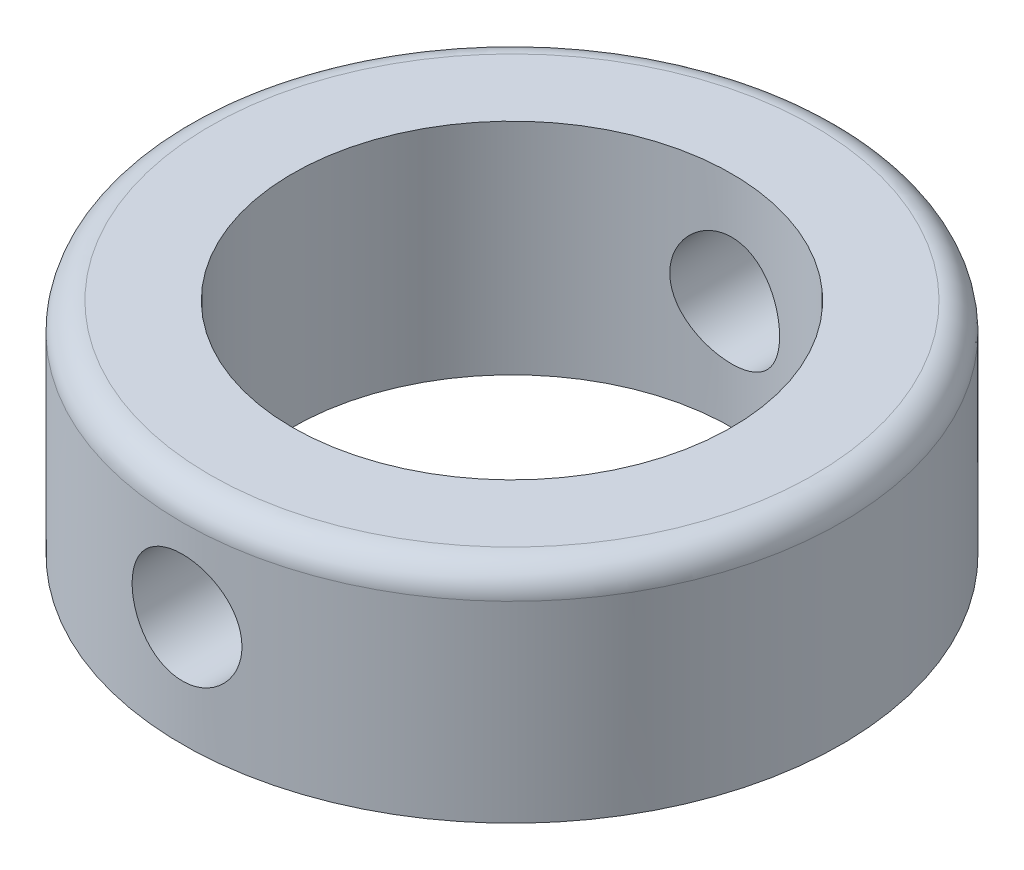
SolidWorks part; units mm, degrees
ref_plane "Front Plane" through (0, 0, 0) normal (0, 0, 1) x (1, 0, 0)
ref_plane "Top Plane" through (0, 0, 0) normal (0, 1, 0) x (1, 0, 0)
ref_plane "Right Plane" through (0, 0, 0) normal (1, 0, 0) x (0, 0, -1)
sketch "Sketch1" plane through (0, 0, 0) normal (0, 0, 1) x (1, 0, 0)
  line L0 (6, 5.9842) -> (0, 5.9842)
  line L1 (0, 5.9842) -> (0, 1.9842)
  line L2 (0, 1.9842) -> (6, 1.9842)
  line L3 (6, 1.9842) -> (6, 5.9842)
  line L4 (0, 5.9842) -> (0, 1.9827) construction
revolve "Revolve1" add sketch "Sketch1" angle 360 about L4
hole_wizard "Ø8.0 (8) Diameter Hole1" positions "Sketch3" profile "Sketch2" hole size "Ø8.0" standard "ANSI Metric"
sketch "Sketch3" plane through (0, 5.9842, 0) normal (0, 1, 0) x (1, 0, 0)
  point P0 (0, 0)
sketch "Sketch2" plane through (0, 5.9842, 0) normal (1, 0, 0) x (0, 0, 1)
  line L0 (0, 0) -> (0, 4)
  line L1 (0, 4) -> (4, 4)
  line L2 (4, 4) -> (4, 0)
  line L5 (4, 0) -> (0, 0)
  line L11 (0, -6.35) -> (0, 107.95) construction
  dimension "Thru Hole Dia." = 8
  dimension "Thru Hole Depth" = 4
ref_plane "Plane1" through (0, 0, 6) normal (0, 0, 1) x (1, 0, 0)
hole_wizard "Ø2.0 (2) Diameter Hole1" positions "Sketch5" profile "Sketch4" hole size "Ø2.0" standard "ANSI Metric"
sketch "Sketch5" plane through (0, 0, 6) normal (0, 0, 1) x (1, 0, 0)
  point P0 (0, 3.9842)
sketch "Sketch4" plane through (0, 3.9842, 6) normal (1, 0, 0) x (0, -1, 0)
  line L0 (0, 0) -> (0, 12.0001)
  line L1 (0, 12.0001) -> (1, 12.0001)
  line L2 (1, 12.0001) -> (1, 0)
  line L5 (1, 0) -> (0, 0)
  line L10 (0, 12.0001) -> (-1, 12.0001) construction
  line L11 (0, -6.35) -> (0, 107.95) construction
  dimension "Hole Dia." = 2
  dimension "Hole Depth" = 12.0001
  dimension "Drill Angle" = 180
fillet "Fillet1" radius 0.5013 1 edges at (0, 5.9842, -6)
